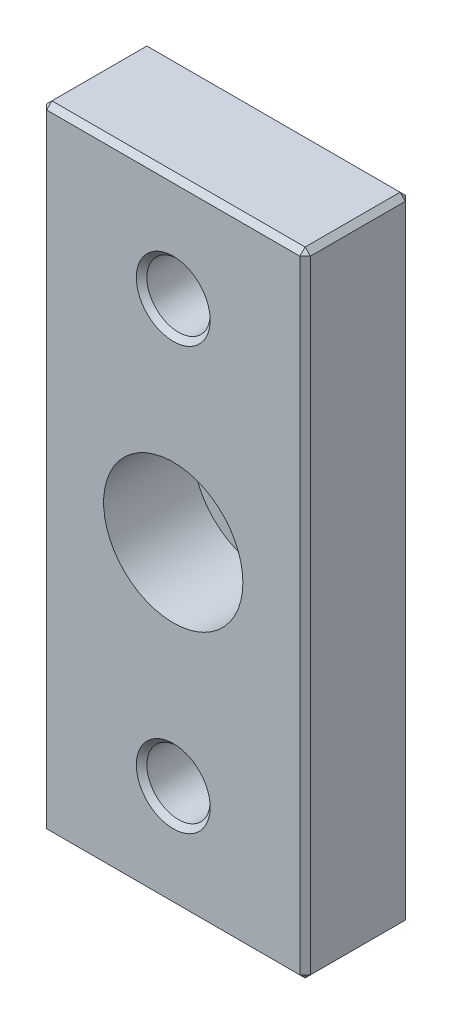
SolidWorks part; units mm, degrees
ref_plane "Plane1" through (0, 0, 0) normal (0, 0, 1) x (1, 0, 0)
ref_plane "Plane2" through (0, 0, 0) normal (0, 1, 0) x (1, 0, 0)
ref_plane "Plane3" through (0, 0, 0) normal (1, 0, 0) x (0, 0, -1)
sketch "Esquisse1" plane through (0, 0, 0) normal (0, 0, 1) x (1, 0, 0)
  line L0 (0, 0) -> (25, 0)
  line L1 (0, 0) -> (0, 60)
  line L2 (25, 60) -> (0, 60)
  line L3 (25, 60) -> (25, 0)
  circle A0 centre (12.5, 50) radius 3
  circle A1 centre (12.5, 10) radius 3
  circle A2 centre (12.5, 30) radius 4.1
  dimension "D3" = 8.2
  dimension "D4" = 6
  dimension "D5" = 6
  dimension "D1" = 60
  dimension "D2" = 25
  dimension "D6" = 10
  dimension "D7" = 30
  dimension "D8" = 50
  dimension "D9" = 12.5
  dimension "D10" = 12.5
  dimension "D11" = 12.5
extrude "Base-Extrusion" add sketch "Esquisse1" along normal blind 10
chamfer "Chanfrein1" distance 0.5 angle 45
sketch "Esquisse2" plane through (0, 0, 10) normal (0, 0, 1) x (1, 0, 0)
  circle A0 centre (12.5, 30) radius 6.6
  dimension "D1" = 13.2
extrude "Enlèv. mat.-Extru.1" cut sketch "Esquisse2" against normal blind 8.5
